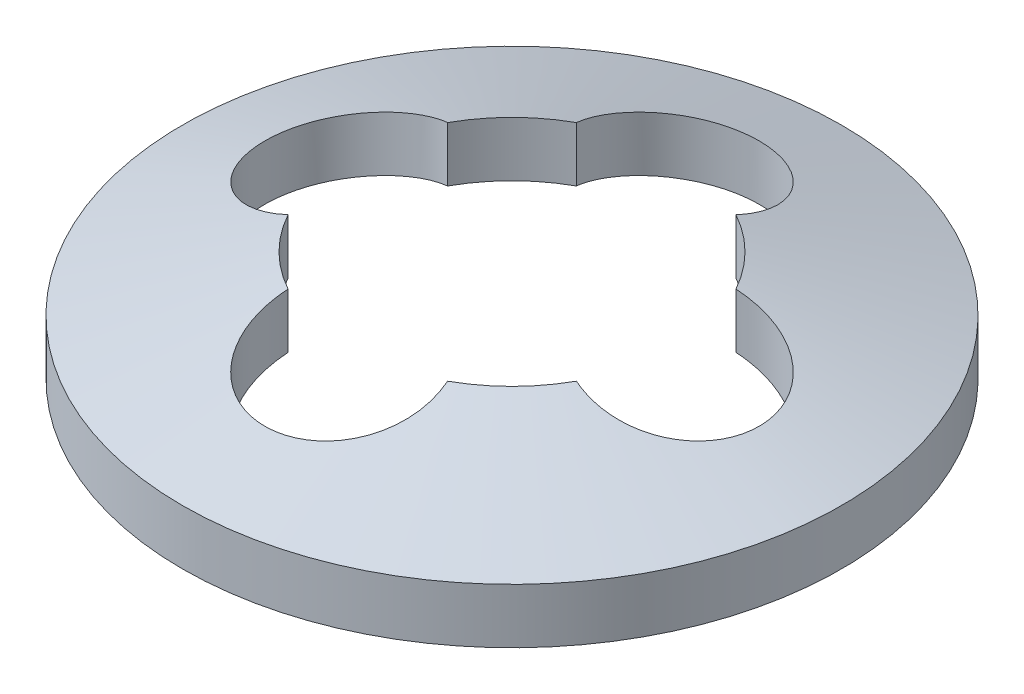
SolidWorks part; units mm, degrees
ref_plane "Plan de face" through (0, 0, 0) normal (0, 0, 1) x (1, 0, 0)
ref_plane "Plan de dessus" through (0, 0, 0) normal (0, 1, 0) x (1, 0, 0)
ref_plane "Plan de droite" through (0, 0, 0) normal (1, 0, 0) x (0, 0, -1)
sketch "Esquisse1" plane through (0, 0, 0) normal (0, 0, 1) x (1, 0, 0)
  line L0 (0, 0) -> (1.5, 0.5)
  line L1 (1.5, 0.5) -> (3, 0.5)
  line L2 (3, 0.5) -> (3, 1)
  line L3 (1.5, 1) -> (3, 1)
  line L4 (1.5, 1) -> (0, 0.5)
  line L5 (0, 0.5) -> (0, 0)
  dimension "D1" = 0.5
  dimension "D2" = 3
  dimension "D3" = 1.5
  dimension "D4" = 1.5
  dimension "D5" = 1
revolve "Révolution1" add sketch "Esquisse1" angle 360 about L2
sketch "Esquisse3" plane through (0, 1, 0) normal (0, 1, 0) x (1, 0, 0)
  line L0 (-0.7479, 0) -> (6.5613, 0) construction
  line L1 (3, 1.9478) -> (3, -2.1889) construction
  arc A0 (2.2738, 1.3125) -> (1.6875, 0.7262) centre (3, 0) ccw
  arc A1 (3.7262, 1.3125) -> (2.2738, 1.3125) centre (3, 1.5) ccw
  arc A2 (4.3125, -0.7262) -> (4.3125, 0.7262) centre (4.5, 0) ccw
  arc A3 (2.2738, -1.3125) -> (3.7262, -1.3125) centre (3, -1.5) ccw
  arc A4 (1.6875, 0.7262) -> (1.6875, -0.7262) centre (1.5, 0) ccw
  arc A5 (4.3125, 0.7262) -> (3.7262, 1.3125) centre (3, 0) ccw
  arc A6 (3.7262, -1.3125) -> (4.3125, -0.7262) centre (3, 0) ccw
  arc A7 (1.6875, -0.7262) -> (2.2738, -1.3125) centre (3, 0) ccw
  dimension "D1" = 3
  dimension "D2" = 1.5
  dimension "D3" = 1.5
  dimension "D4" = 1.5
  dimension "D5" = 1.5
extrude "Enlèv. mat.-Extru.3" cut sketch "Esquisse3" against normal through all
